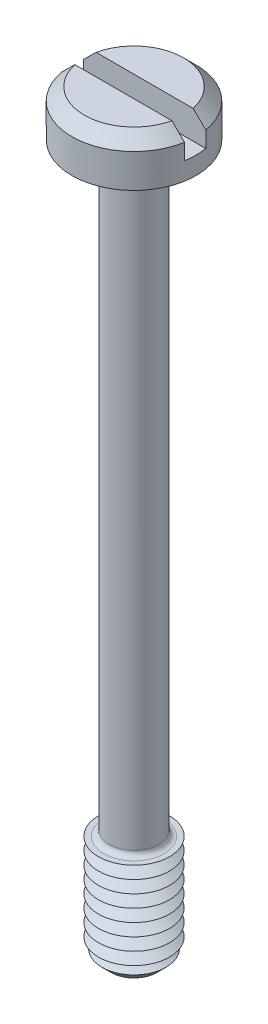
SolidWorks part; units mm, degrees
ref_plane "Front Plane" through (0, 0, 0) normal (0, 0, 1) x (1, 0, 0)
ref_plane "Top Plane" through (0, 0, 0) normal (0, 1, 0) x (1, 0, 0)
ref_plane "Right Plane" through (0, 0, 0) normal (1, 0, 0) x (0, 0, -1)
sketch "Sketch1" plane through (0, 0, 0) normal (0, 1, 0) x (1, 0, 0)
  circle A0 centre (0, 0) radius 3.5
  dimension "D1" = 7
extrude "Boss-Extrude1" add sketch "Sketch1" along normal blind 2.6
sketch "Sketch2" plane through (0, 0, 0) normal (0, -1, 0) x (1, 0, 0)
  circle A0 centre (0, 0) radius 1.4
  dimension "D1" = 2.8
extrude "Boss-Extrude2" add sketch "Sketch2" along normal blind 40
sketch "Sketch3" plane through (0, -40, 0) normal (0, -1, 0) x (1, 0, 0)
  circle A0 centre (0, 0) radius 2
  dimension "D1" = 4
extrude "Boss-Extrude3" add sketch "Sketch3" against normal blind 6
chamfer "Chamfer1" distance 0.7 angle 45 1 edges at (0, -40, -2)
sketch "Sketch4" plane through (0, 0, 0) normal (1, 0, 0) x (0, 0, -1)
  line L0 (0, -6.5871) -> (0, -12.0372) construction
sketch "Sketch5" plane through (0, 0, 0) normal (1, 0, 0) x (0, 0, -1)
  line L0 (-2, -34) -> (-1.3938, -34.35)
  line L1 (-1.3938, -34.35) -> (-2, -34.7)
  line L2 (-2, -34) -> (-2, -39.3) construction
  line L3 (-2, -34.7) -> (-2, -34)
  dimension "D1" = 0.7
revolve "Cut-Revolve1" cut sketch "Sketch5" angle 360 about L0
pattern_linear "LPattern1" count 8 spacing 0.7 along (0, -1, 0) of "Cut-Revolve1"
fillet "Fillet1" radius 0.3 2 edges at (0, -34, -1.4) (0, 0, -1.4)
chamfer "Chamfer2" distance 0.7 angle 45 1 edges at (0, 2.6, 3.5)
sketch "Sketch6" plane through (0, 2.6, 0) normal (0, 1, 0) x (1, 0, 0)
  line L1 (3.5, -0.6) -> (-3.5, -0.6)
  line L2 (3.5, -0.6) -> (3.5, 0.6)
  line L3 (3.5, 0.6) -> (-3.5, 0.6)
  line L4 (-3.5, -0.6) -> (-3.5, 0.6)
  line L5 (3.5, -0.6) -> (-3.5, 0.6) construction
  line L6 (3.5, 0.6) -> (-3.5, -0.6) construction
  circle A0 centre (0, 0) radius 3.5 construction
  point P0 (0, 0)
  dimension "D1" = 1.2
extrude "Cut-Extrude1" cut sketch "Sketch6" against normal blind 1.6
